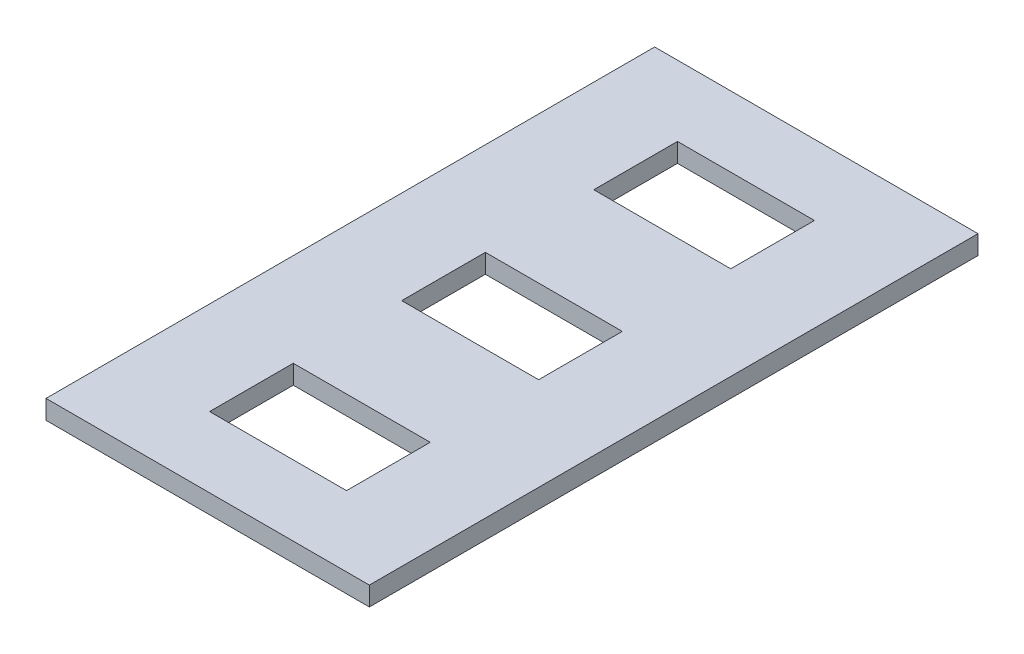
SolidWorks part; units mm, degrees
ref_plane "前基準面" through (0, 0, 0) normal (0, 0, 1) x (1, 0, 0)
ref_plane "上基準面" through (0, 0, 0) normal (0, 1, 0) x (1, 0, 0)
ref_plane "右基準面" through (0, 0, 0) normal (1, 0, 0) x (0, 0, -1)
sketch "草圖1" plane through (0, 0, 0) normal (0, 1, 0) x (1, 0, 0)
  line L1 (-42.5, 80) -> (42.5, 80)
  line L2 (-42.5, 80) -> (-42.5, -80)
  line L3 (-42.5, -80) -> (42.5, -80)
  line L4 (42.5, 80) -> (42.5, -80)
  line L5 (-42.5, 80) -> (42.5, -80) construction
  line L6 (-42.5, -80) -> (42.5, 80) construction
  line L7 (-18, 11) -> (18, 11)
  line L8 (-18, 11) -> (-18, -11)
  line L9 (-18, -11) -> (18, -11)
  line L10 (18, 11) -> (18, -11)
  line L11 (-18, 11) -> (18, -11) construction
  line L12 (-18, -11) -> (18, 11) construction
  line L13 (-18, 61.5) -> (18, 61.5)
  line L14 (-18, 61.5) -> (-18, 39.5)
  line L15 (-18, 39.5) -> (18, 39.5)
  line L16 (18, 61.5) -> (18, 39.5)
  line L17 (-18, 61.5) -> (18, 39.5) construction
  line L18 (-18, 39.5) -> (18, 61.5) construction
  line L19 (-18, -39.5) -> (18, -39.5)
  line L20 (-18, -39.5) -> (-18, -61.5)
  line L21 (-18, -61.5) -> (18, -61.5)
  line L22 (18, -39.5) -> (18, -61.5)
  line L23 (-18, -39.5) -> (18, -61.5) construction
  line L24 (-18, -61.5) -> (18, -39.5) construction
  point P0 (0, 0)
  point P6 (0, 0)
  point P11 (0, 50.5)
  point P16 (0, -50.5)
  dimension "D1" = 160
  dimension "D2" = 85
  dimension "D3" = 22
  dimension "D4" = 36
  dimension "D5" = 50.5
  dimension "D6" = 50.5
extrude "填料-伸長1" add sketch "草圖1" along normal blind 5
